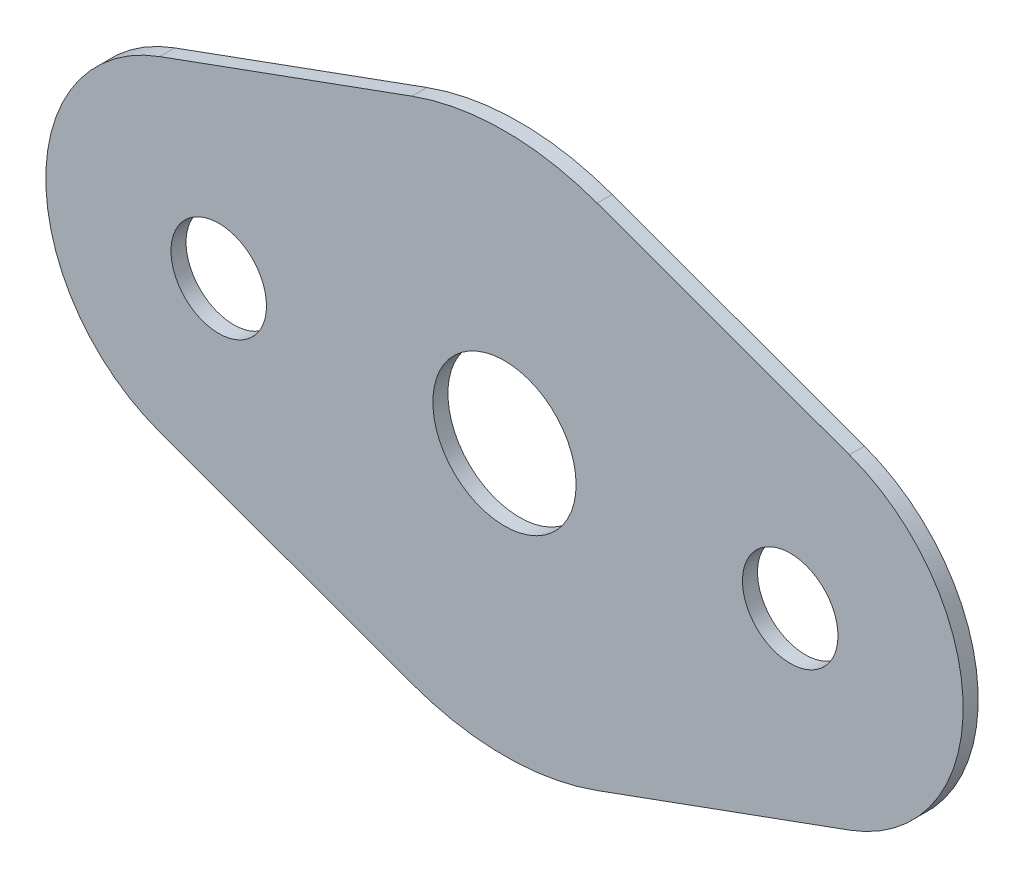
SolidWorks part; units mm, degrees
ref_plane "Front" through (0, 0, 0) normal (0, 0, 1) x (1, 0, 0)
ref_plane "Top" through (0, 0, 0) normal (0, 1, 0) x (1, 0, 0)
ref_plane "Right" through (0, 0, 0) normal (1, 0, 0) x (0, 0, -1)
sketch "Sketch1" plane through (0, 0, 0) normal (0, 0, 1) x (1, 0, 0)
  line L0 (-19, 0) -> (19, 0) construction
  line L8 (6.1579, -16.9139) -> (22.9342, -10.8061)
  line L9 (22.9342, 10.8061) -> (6.1579, 16.9139)
  line L10 (-6.1579, 16.9139) -> (-22.9342, 10.8061)
  line L11 (-22.9342, -10.8061) -> (-6.1579, -16.9139)
  circle A3 centre (19, 0) radius 3.175
  arc A8 (-6.1579, -16.9139) -> (6.1579, -16.9139) centre (0, 0) ccw
  arc A9 (22.9342, -10.8061) -> (22.9342, 10.8061) centre (19, 0) ccw
  arc A10 (6.1579, 16.9139) -> (-6.1579, 16.9139) centre (0, 0) ccw
  arc A11 (-22.9342, 10.8061) -> (-22.9342, -10.8061) centre (-19, 0) ccw
  circle A12 centre (0, 0) radius 4.7625
  circle A13 centre (-19, 0) radius 3.175
  dimension "D3" = 18
  dimension "D4" = 11.5
  dimension "D5" = 6.35
  dimension "D6" = 6.35
  dimension "D7" = 11.5
  dimension "D8" = 9.525
  dimension "D1" = 38
  dimension "D2" = 19
extrude "Base-Extrude" add sketch "Sketch1" along normal blind 1
